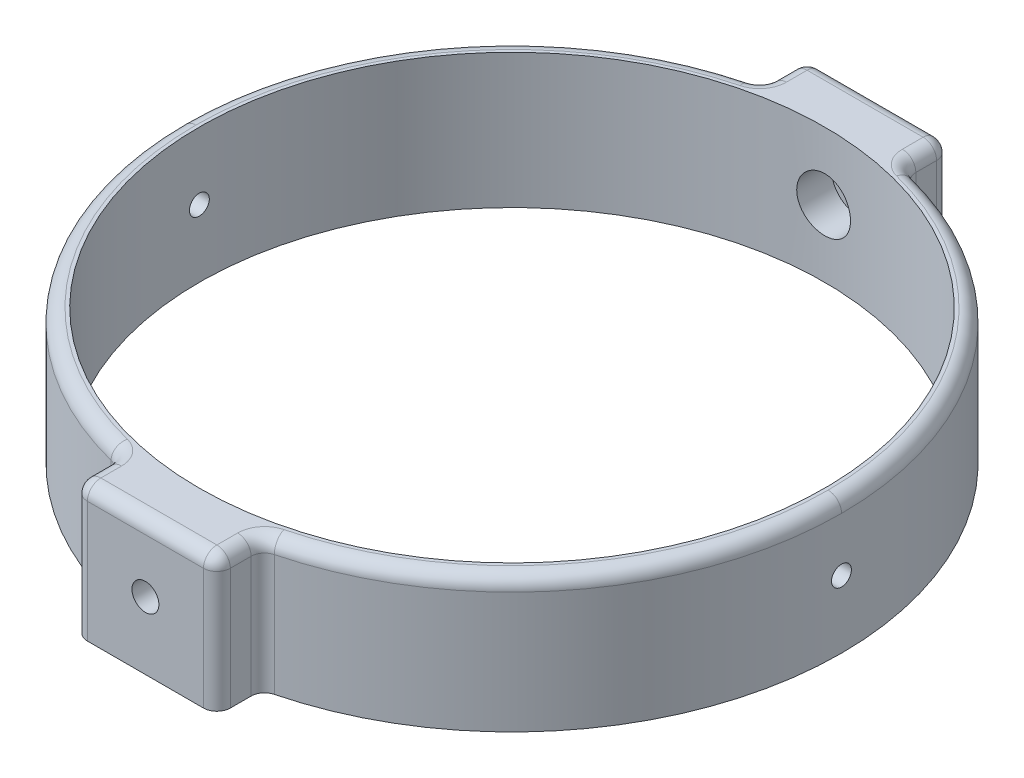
SolidWorks part; units mm, degrees
ref_plane "Front Plane" through (0, 0, 0) normal (0, 0, 1) x (1, 0, 0)
ref_plane "Top Plane" through (0, 0, 0) normal (0, 1, 0) x (1, 0, 0)
ref_plane "Right Plane" through (0, 0, 0) normal (1, 0, 0) x (0, 0, -1)
sketch "Sketch1" plane through (0, 0, 0) normal (0, 1, 0) x (1, 0, 0)
  line L0 (-42.1342, 0) -> (49.266, 0) construction
  line L1 (1.6265, 45.6552) -> (1.6265, -33.6397) construction
  line L2 (1.6265, 45.6552) -> (-10.6265, 45.6552) construction
  line L3 (1.6265, 45.6552) -> (10.6265, 45.6552) construction
  line L4 (-10.6265, 45.6552) -> (-10.6265, 47.8339) construction
  line L5 (10.6265, 45.6552) -> (10.6265, 47.8339) construction
  line L7 (10.6265, 47.8339) -> (10.6265, 54.5)
  line L8 (10.6265, 54.5) -> (-10.6265, 54.5)
  line L9 (-10.6265, 47.8339) -> (-10.6265, 54.5)
  line L10 (-49, 0) -> (49, 0)
  circle A1 centre (0, 0) radius 49 construction
  arc A2 (-10.6265, 47.8339) -> (-49, 0) centre (0, 0) ccw
  arc A3 (10.6265, 47.8339) -> (49, 0) centre (0, 0) cw
  arc A4 (-46.5, 0) -> (46.5, 0) centre (0, 0) cw
  dimension "D1" = 46.5
  dimension "D2" = 98
  dimension "D3" = 54.5
  dimension "D4" = 9
extrude "Boss-Extrude1" add sketch "Sketch1" along normal blind 20 contours L10 A4 A3 L7 L8 L9 A2
ref_plane "Plane3" through (0, 0, -51.5) normal (0, 0, -1) x (-1, 0, 0)
sketch "Sketch7" plane through (0, 0, -51.5) normal (0, 0, -1) x (-1, 0, 0)
  circle A0 centre (0, 10) radius 4
  point P2 (0, 7.5)
  point P3 (0, 10)
  dimension "D1" = 8
extrude "Cut-Extrude4" cut sketch "Sketch7" against normal blind 7
sketch "Sketch8" plane through (0, 0, -51.5) normal (0, 0, 1) x (1, 0, 0)
  circle A0 centre (0, 10) radius 2
  dimension "D1" = 4
extrude "Cut-Extrude5" cut sketch "Sketch8" along normal through all both and the other way through all contours A0
fillet "Fillet1" radius 2 9 edges at (-38.2211, 20, -30.6619) (38.2211, 20, -30.6619) (-10.6265, 10, -47.8339) (-10.6265, 20, -51.1669) (-10.6265, 10, -54.5) (10.6265, 20, -51.1669) (0, 20, -54.5) (10.6265, 10, -54.5) (10.6265, 10, -47.8339)
mirror "Mirror3" about plane through (0, 20, 0) normal (0, 0, -1) of "Cut-Extrude5", "Cut-Extrude4", "Boss-Extrude1", "Fillet1"
sketch "Sketch9" plane through (0, 0, 0) normal (1, 0, 0) x (0, 0, -1)
  circle A0 centre (0, 10) radius 1.475
  dimension "D1" = 2.95
extrude "Cut-Extrude6" cut sketch "Sketch9" against normal through all both and the other way through all contours A0
